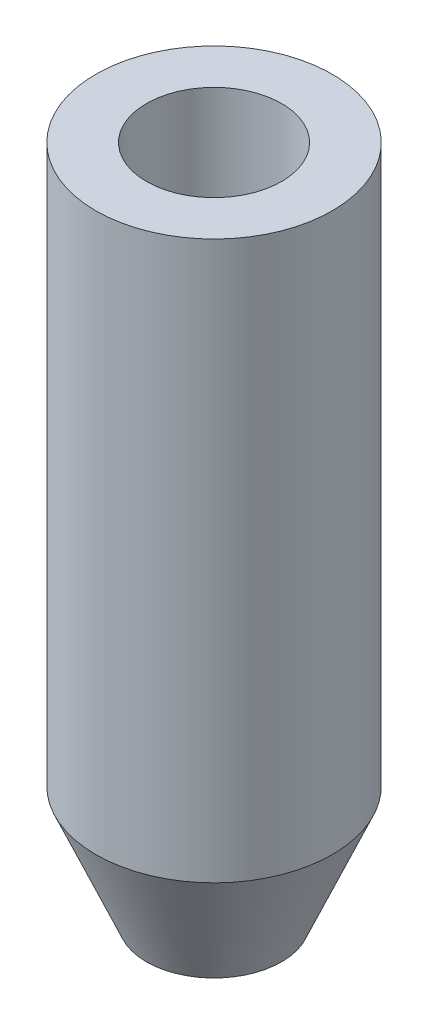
SolidWorks part; units mm, degrees
ref_plane "Front Plane" through (0, 0, 0) normal (0, 0, 1) x (1, 0, 0)
ref_plane "Top Plane" through (0, 0, 0) normal (0, 1, 0) x (1, 0, 0)
ref_plane "Right Plane" through (0, 0, 0) normal (1, 0, 0) x (0, 0, -1)
sketch "Sketch1" plane through (0, 0, 0) normal (0, 1, 0) x (1, 0, 0)
  circle A0 centre (0, 0) radius 3.5
  dimension "D1" = 7
extrude "Boss-Extrude1" add sketch "Sketch1" along normal mid plane 20 contours A0
chamfer "Chamfer1" distance 1.5 distance2 3.5 1 edges at (0, -10, 3.5)
sketch "Sketch2" plane through (0, -10, 0) normal (0, -1, 0) x (1, 0, 0)
  circle A0 centre (0, 0) radius 0.875
  dimension "D1" = 1.75
extrude "Cut-Extrude1" cut sketch "Sketch2" against normal through all both and the other way through all
sketch "Sketch3" plane through (0, -10, 0) normal (0, -1, 0) x (1, 0, 0)
  circle A0 centre (0, 0) radius 1.35
  dimension "D1" = 2.7
extrude "Cut-Extrude2" cut sketch "Sketch3" against normal blind 3.5
sketch "Sketch4" plane through (0, 10, 0) normal (0, 1, 0) x (1, 0, 0)
  circle A0 centre (0, 0) radius 2
  dimension "D1" = 4
extrude "Cut-Extrude3" cut sketch "Sketch4" against normal blind 5
